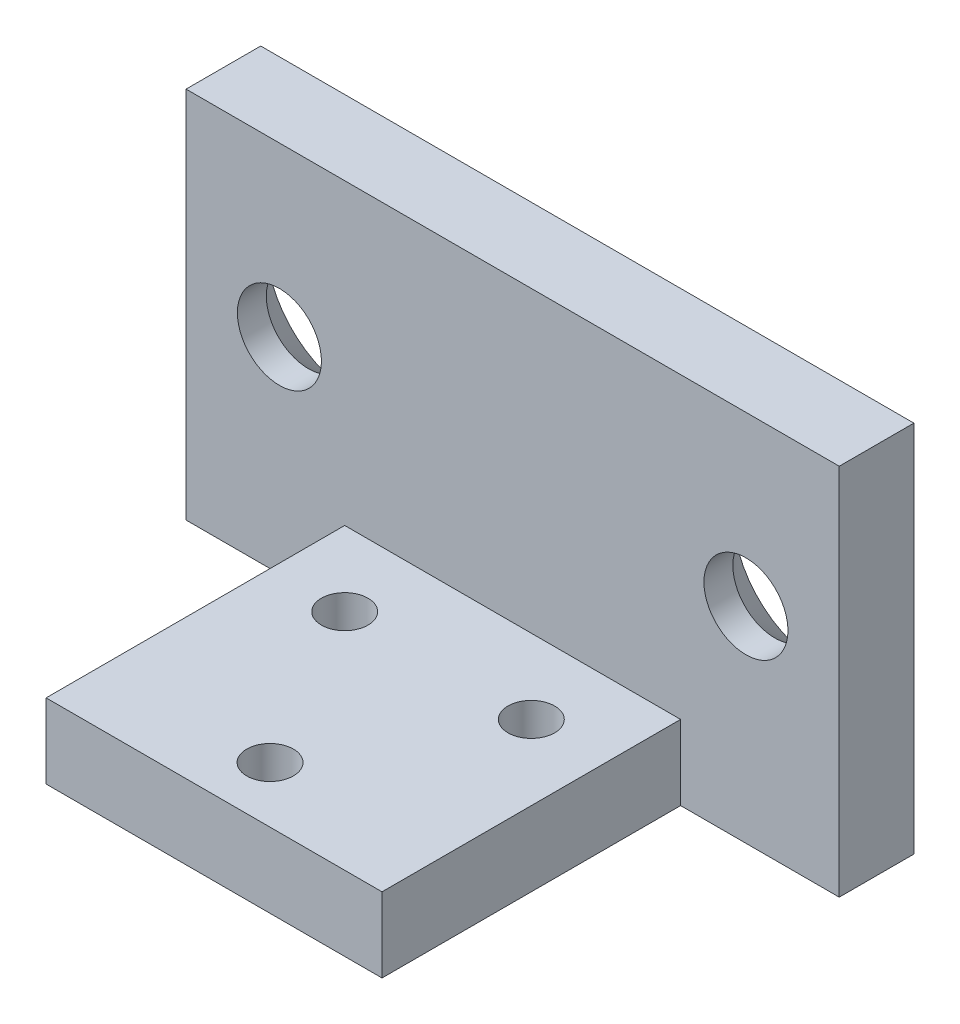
SolidWorks part; units mm, degrees
ref_plane "Face" through (0, 0, 0) normal (0, 0, 1) x (1, 0, 0)
ref_plane "Dessus" through (0, 0, 0) normal (0, 1, 0) x (1, 0, 0)
ref_plane "Droite" through (0, 0, 0) normal (1, 0, 0) x (0, 0, -1)
sketch "Esquisse1" plane through (0, 0, 0) normal (0, 0, 1) x (1, 0, 0)
  line L1 (0, 0) -> (35, 0)
  line L2 (0, 0) -> (0, 20)
  line L3 (0, 20) -> (35, 20)
  line L4 (35, 0) -> (35, 20)
  dimension "D1" = 35
  dimension "D2" = 20
extrude "Extrusion1" add sketch "Esquisse1" along normal blind 4
sketch "Esquisse2" plane through (0, 0, 4) normal (0, 0, 1) x (1, 0, 0)
  line L0 (0, 0) -> (35, 0) construction
  line L1 (8.5, 0) -> (26.5, 0)
  line L2 (8.5, 0) -> (8.5, 4)
  line L3 (8.5, 4) -> (26.5, 4)
  line L4 (26.5, 0) -> (26.5, 4)
  line L5 (17.5, 20) -> (17.5, -1.4503) construction
  line L6 (35, 20) -> (0, 20) construction
  dimension "D1" = 18
  dimension "D2" = 4
extrude "Extrusion2" add sketch "Esquisse2" along normal blind 16
hole_wizard "Fraisage pour vis à tête fraisée M41" positions "Esquisse4" profile "Esquisse3" countersink size "M4" standard "Ansi Métrique"
sketch "Esquisse4" plane through (0, 0, 0) normal (0, 0, -1) x (-1, 0, 0)
  line L0 (0, 0) -> (-35, 0) construction
  line L1 (-17.5, 0) -> (-17.5, 14.7666) construction
  line L2 (-35, 20) -> (0, 20) construction
  point P0 (-5, 11)
  point P2 (-30, 11)
  dimension "D1" = 9
  dimension "D2" = 9
  dimension "D3" = 12.5
  dimension "D4" = 12.5
sketch "Esquisse3" plane through (5, 11, 0) normal (1, 0, 0) x (0, 1, 0)
  line L0 (0, 0) -> (0, 20)
  line L1 (0, 20) -> (2.25, 20)
  line L2 (2.25, 20) -> (2.25, 2.45)
  line L3 (2.25, 2.45) -> (4.7, 0)
  line L5 (4.7, 0) -> (0, 0)
  line L6 (-2.25, 2.45) -> (-4.7, 0) construction
  line L11 (0, -6.35) -> (0, 107.95) construction
  dimension "Diamètre du perçage jusqu'au prochain" = 4.5
  dimension "Profondeur du perçage jusqu'au prochain" = 20
  dimension "Diamètre du fraisage entrant" = 9.4
  dimension "Angle du fraisage entrant" = 90
hole_wizard "Trou taraudé M3x0.51" positions "Esquisse8" profile "Esquisse7" tap size "M3x0.5" standard "ISO"
sketch "Esquisse8" plane through (0, 4, 0) normal (0, 1, 0) x (-1, 0, 0)
  line L0 (-17.5, 4) -> (-17.5, 21.4503) construction
  line L1 (-35, 4) -> (0, 4) construction
  point P0 (-12.5, 8)
  point P1 (-22.5, 8)
  point P3 (-17.5, 17)
  dimension "D1" = 4
  dimension "D2" = 4
  dimension "D3" = 5
  dimension "D4" = 5
  dimension "D5" = 9
sketch "Esquisse7" plane through (12.5, 4, 8) normal (1, 0, 0) x (0, 0, 1)
  line L0 (0, 0) -> (0, 4.0001)
  line L1 (0, 4.0001) -> (1.25, 4.0001)
  line L2 (1.25, 4.0001) -> (1.25, 0)
  line L5 (1.25, 0) -> (0, 0)
  line L11 (0, -6.35) -> (0, 107.95) construction
  dimension "Diamètre du trou pour taraudage jusqu'au prochain" = 2.5
  dimension "Profondeur du trou pour taraudage jusqu'au prochain" = 4.0001
